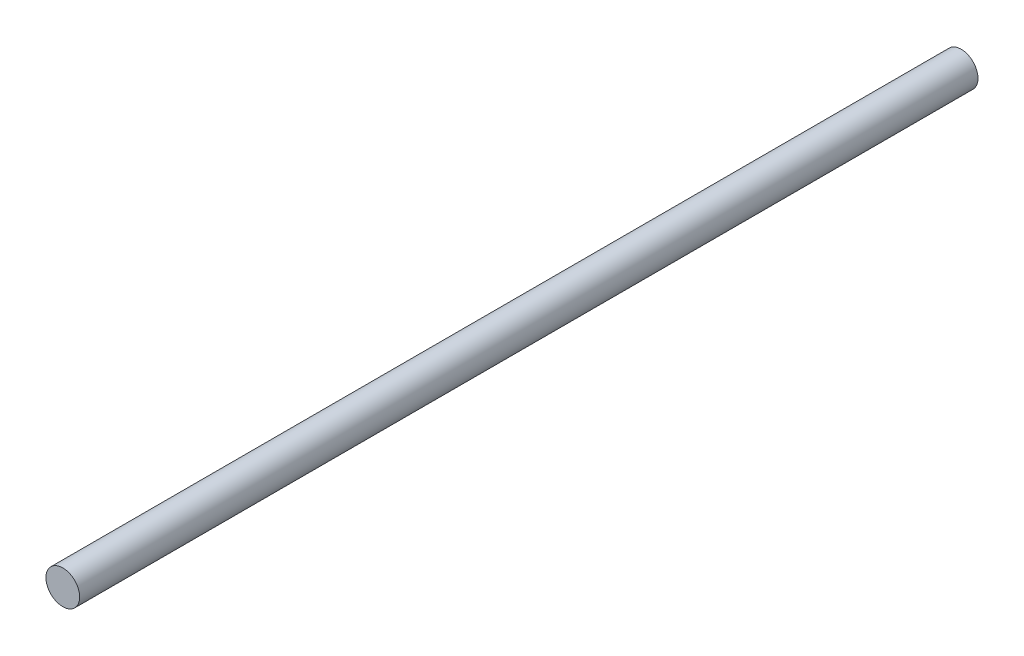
SolidWorks part; units mm, degrees
ref_plane "Front Plane" through (0, 0, 0) normal (0, 0, 1) x (1, 0, 0)
ref_plane "Top Plane" through (0, 0, 0) normal (0, 1, 0) x (1, 0, 0)
ref_plane "Right Plane" through (0, 0, 0) normal (1, 0, 0) x (0, 0, -1)
sketch "Sketch1" plane through (0, 0, 0) normal (0, 0, 1) x (1, 0, 0)
  circle A0 centre (0, 0) radius 30
  dimension "D1" = 60
extrude "Boss-Extrude1" add sketch "Sketch1" against normal blind 1600
